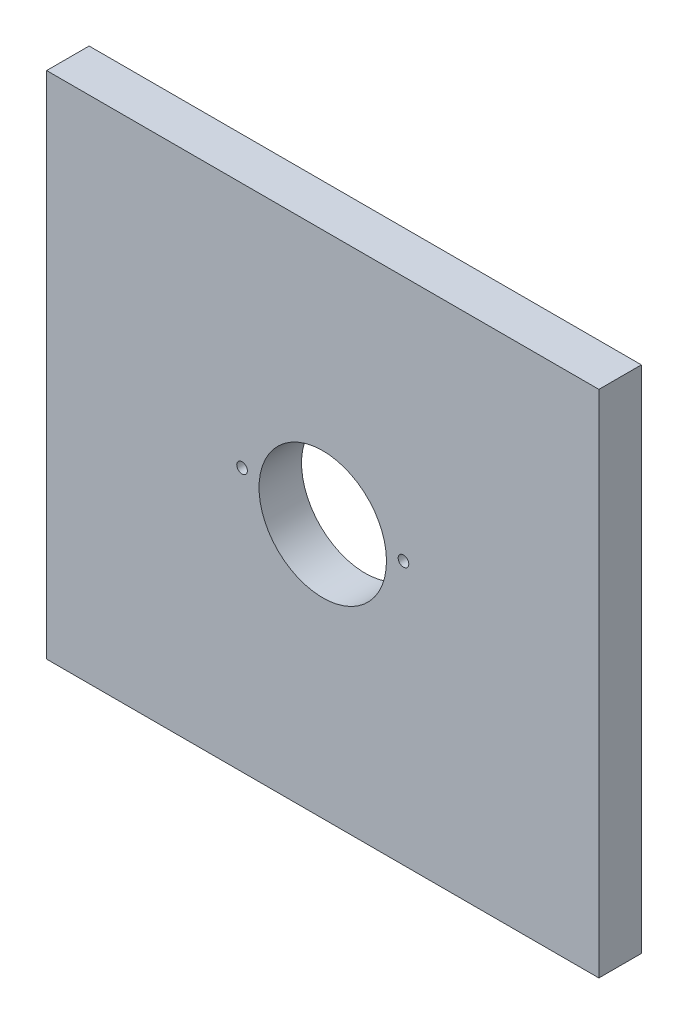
SolidWorks part; units mm, degrees
ref_plane "Face" through (0, 0, 0) normal (0, 0, 1) x (1, 0, 0)
ref_plane "Dessus" through (0, 0, 0) normal (0, 1, 0) x (1, 0, 0)
ref_plane "Droite" through (0, 0, 0) normal (1, 0, 0) x (0, 0, -1)
sketch "Esquisse1" plane through (0, 0, 0) normal (0, 0, 1) x (1, 0, 0)
  line L1 (-70.901, 0) -> (59.099, 0)
  line L2 (-70.901, 0) -> (-70.901, -120)
  line L3 (-70.901, -120) -> (59.099, -120)
  line L4 (59.099, 0) -> (59.099, -120)
  circle A0 centre (-5.901, -60) radius 15
  dimension "D3" = 65
  dimension "D4" = 60
  dimension "D5" = 30
  dimension "D1" = 130
  dimension "D2" = 120
extrude "Base-Extrusion" add sketch "Esquisse1" along normal blind 10
sketch "Esquisse2" plane through (0, 0, 10) normal (0, 0, 1) x (1, 0, 0)
  line L0 (-70.901, 0) -> (-70.901, -120) construction
  line L1 (59.099, -120) -> (59.099, 0) construction
  circle A0 centre (-24.901, -58) radius 1.25
  circle A1 centre (13.099, -58) radius 1.25
  dimension "D1" = 38
  dimension "D2" = 46
  dimension "D3" = 46
extrude "Enlèv. mat.-Extru.1" cut sketch "Esquisse2" against normal through all
